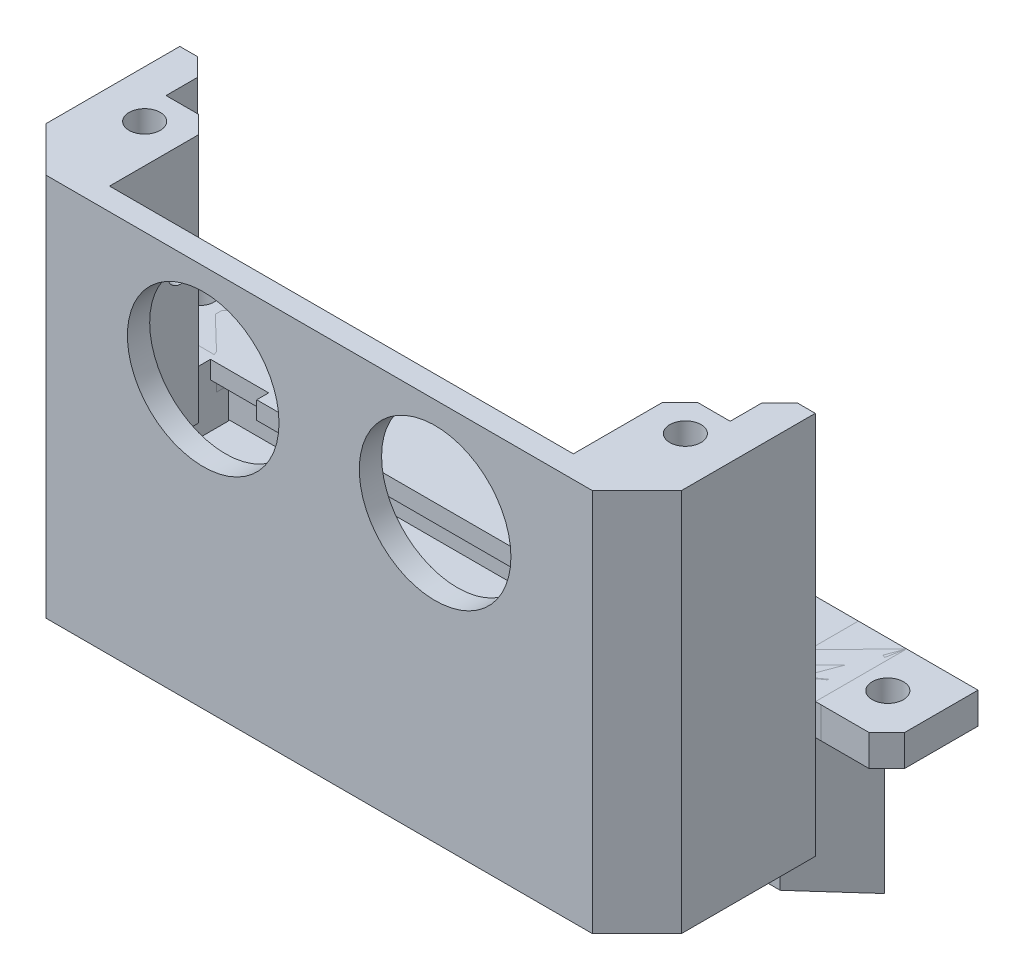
SolidWorks part; units mm, degrees
ref_plane "Front Plane" through (0, 0, 0) normal (0, 0, 1) x (1, 0, 0)
ref_plane "Top Plane" through (0, 0, 0) normal (0, 1, 0) x (1, 0, 0)
ref_plane "Right Plane" through (0, 0, 0) normal (1, 0, 0) x (0, 0, -1)
sketch "Sketch1" plane through (0, 0, 0) normal (1, 0, 0) x (0, 0, -1)
  line L0 (9.3411, 20.25) -> (11.3411, 20.25)
  line L1 (11.3411, -22.75) -> (11.3411, 22.75) construction
  line L2 (11.3411, -7.75) -> (11.3411, 20.25)
  line L3 (-7.5, -9.75) -> (-7.5, -14.75)
  line L4 (-10, -20.7698) -> (-10, 20.25)
  line L5 (9.3411, -9.75) -> (9.3411, 20.25)
  line L6 (-10, 20.25) -> (-7.5, 20.25)
  line L7 (-10, -22.75) -> (-10, 22.75) construction
  line L8 (-7.5, -14.75) -> (11.5, -14.75)
  line L9 (-2.5, -9.75) -> (11.5, -9.75) construction
  line L10 (9.3411, -20.75) -> (9.3411, 20.75) construction
  line L11 (11.5, -9.75) -> (11.5, -14.75) construction
  line L12 (9.3411, 20.75) -> (-8, 20.75) construction
  line L13 (-8, -20.75) -> (-8, 20.75) construction
  line L14 (9.3411, -20.75) -> (-8, -20.75) construction
  line L15 (-7.5, 20.25) -> (-7.5, -1.75)
  line L16 (11.5, -9.75) -> (9.3411, -9.75)
  line L17 (-7.5, -1.75) -> (-2.5, -1.75)
  line L18 (-2.5, -1.75) -> (-2.5, -9.75)
  line L19 (-2.5, -9.75) -> (-7.5, -9.75)
  line L20 (-7.5, -1.75) -> (-7.5, 20.25)
  line L21 (11.5, -14.75) -> (11.5, -9.75)
  line L22 (20.2433, -7.75) -> (20.2433, -22.4772)
  line L23 (15.7922, -7.75) -> (15.7922, -19.75) construction
  line L24 (11.3411, 22.75) -> (-10, 22.75) construction
  line L25 (-10, -20.7698) -> (8.5468, -20.7698)
  line L28 (11.3411, -22.75) -> (-10, -22.75) construction
  line L29 (20.2433, -32.7501) -> (11.5, -28.1484)
  line L30 (20.2433, -30.7482) -> (20.2433, -22.4772)
  line L31 (8.5468, -20.7698) -> (8.5468, -26.5822)
  line L32 (11.5, -28.1484) -> (8.5468, -26.5822)
  line L33 (20.2433, -32.7501) -> (20.2433, -30.7482)
  line L34 (20.2433, -7.75) -> (11.3411, -7.75)
  point P0 (0, 0)
  dimension "D1" = 19
  dimension "D2" = 12
  dimension "D5" = 22
  dimension "D6" = 8
  dimension "D7" = 5
  dimension "D3" = 5
  dimension "D4" = 2
extrude "Boss-Extrude1" add sketch "Sketch1" along normal blind 71.25
sketch "Sketch3" plane through (0, 20.25, 0) normal (0, 1, 0) x (1, 0, 0)
  line L0 (35.625, -10) -> (0, -10) construction
  line L2 (35.625, -10) -> (71.25, -10) construction
  line L3 (35.625, -10) -> (10.625, -10) construction
  line L4 (35.625, -10) -> (35.625, 35.4593) construction
  line L6 (10.625, -10) -> (10.625, 11.3411)
  line L8 (10.625, 11.3411) -> (0, 11.3411)
  line L9 (0, 11.3411) -> (0, -10)
  line L10 (10.625, -10) -> (0, -10)
  line L11 (60.625, -10) -> (71.25, -10)
  line L12 (71.25, 11.3411) -> (71.25, -10)
  line L13 (60.625, 11.3411) -> (71.25, 11.3411)
  line L14 (60.625, -10) -> (60.625, 11.3411)
  dimension "D1" = 71.25
  dimension "D2" = 35.625
  dimension "D3" = 25
  dimension "D4" = 50
  dimension "D5" = 10.625
extrude "Boss-Extrude2" add sketch "Sketch3" against normal blind 28
sketch "Sketch4" plane through (0, 20.25, 0) normal (0, 1, 0) x (1, 0, 0)
  line L0 (0, -10) -> (4.1022, -10)
  line L2 (35.625, 11.3411) -> (35.625, -10) construction
  line L4 (4.1022, -10) -> (4.1022, 11.3411)
  line L5 (71.25, 11.3411) -> (0, 11.3411) construction
  line L6 (4.1022, 11.3411) -> (0, 11.3411)
  line L7 (0, 11.3411) -> (0, -10)
  line L8 (71.25, 11.3411) -> (71.25, -10)
  line L9 (67.1478, 11.3411) -> (71.25, 11.3411)
  line L10 (67.1478, -10) -> (67.1478, 11.3411)
  line L11 (71.25, -10) -> (67.1478, -10)
  dimension "D1" = 63.0456
extrude "Boss-Extrude3" add sketch "Sketch4" against normal blind 41
sketch "Sketch7" plane through (0, 20.25, 0) normal (0, 1, 0) x (1, 0, 0)
  line L0 (35.625, -10) -> (35.625, 9.3411) construction
  line L2 (60.625, 9.3411) -> (10.625, 9.3411) construction
  line L3 (0, -10) -> (10.625, 11.5) construction
  line L4 (10.625, -7.5) -> (10.625, -10) construction
  line L5 (10.625, -10) -> (0, 11.3411) construction
  circle A0 centre (5.3125, 0.75) radius 1.75
  circle A1 centre (65.9375, 0.75) radius 1.75
  dimension "D1" = 3.5
extrude "Cut-Extrude1" cut sketch "Sketch7" against normal blind 9
sketch "Sketch9" plane through (0, -1.75, 0) normal (0, 1, 0) x (1, 0, 0)
  line L0 (10.625, -7.5) -> (32.125, -7.5) construction
  line L1 (60.625, -7.5) -> (39.125, -7.5) construction
  line L2 (31.425, -6.1941) -> (31.425, -2.5)
  line L3 (39.125, -7.5) -> (60.625, -7.5) construction
  line L4 (60.625, -2.5) -> (10.625, -2.5) construction
  line L5 (32.825, -6.1941) -> (32.825, -2.5)
  line L6 (10.625, -2.5) -> (60.625, -2.5) construction
  line L7 (33.825, -6.1941) -> (33.825, -2.5)
  line L8 (33.825, -2.5) -> (33.825, -6.1941)
  line L9 (35.225, -6.1941) -> (35.225, -2.5)
  line L10 (36.225, -6.1941) -> (36.225, -2.5)
  line L11 (36.225, -2.5) -> (37.625, -2.5)
  line L12 (37.625, -2.5) -> (37.625, -6.1941)
  line L13 (38.625, -6.1941) -> (38.625, -2.5)
  line L14 (38.625, -2.5) -> (40.025, -2.5)
  line L15 (40.025, -2.5) -> (40.025, -6.1941)
  line L16 (32.825, -2.5) -> (31.425, -2.5)
  line L17 (35.225, -2.5) -> (33.825, -2.5)
  line L18 (60.625, -2.5) -> (35.225, -2.5) construction
  line L19 (60.625, -2.5) -> (10.625, -2.5) construction
  line L20 (60.625, -7.5) -> (10.625, -7.5) construction
  line L21 (10.625, -7.5) -> (35.625, -7.5) construction
  line L22 (35.625, -7.5) -> (35.625, -2.5) construction
  arc A0 (31.425, -6.1941) -> (32.825, -6.1941) centre (32.125, -6.1941) ccw
  arc A1 (33.825, -6.1941) -> (35.225, -6.1941) centre (34.525, -6.1941) ccw
  arc A2 (36.225, -6.1941) -> (37.625, -6.1941) centre (36.925, -6.1941) ccw
  arc A3 (38.625, -6.1941) -> (40.025, -6.1941) centre (39.325, -6.1941) ccw
  point P7 (31.425, -4.347)
  point P8 (40.025, -4.347)
  dimension "D2" = 1.4
  dimension "D3" = 4
  dimension "D1" = 1
  dimension "D4" = 8.6
extrude "Cut-Extrude3" cut sketch "Sketch9" against normal blind 10 contours L2 A0 L5 M2 | L7 A1 L9 M2 | L10 L11 L12 A2 | L13 L14 L15 A3
sketch "Sketch10" plane through (0, -14.75, 0) normal (0, 1, 0) x (1, 0, 0)
  line L0 (4.1022, 11.3411) -> (67.25, 11.5) construction
  line L1 (67.25, 11.5) -> (35.6761, 11.4205) construction
  line L2 (35.6761, 11.4205) -> (35.625, -7.5) construction
  line L3 (67.1478, -7.5) -> (4.1022, -7.5) construction
  line L4 (35.6761, 11.4205) -> (67.25, 11.5) construction
  line L5 (35.6505, 1.9603) -> (57.6505, 1.9603) construction
  circle A0 centre (35.6505, 1.9603) radius 8.25
  circle A1 centre (57.6505, 1.9603) radius 8.25
  circle A2 centre (13.6509, 2.0791) radius 8.25
  dimension "D1" = 16.5
  dimension "D3" = 16.5
  dimension "D2" = 22
sketch "Sketch17" plane through (0, 20.25, 0) normal (0, 1, 0) x (1, 0, 0)
  line L0 (10.625, 9.3411) -> (10.625, 8.0011) construction
  line L1 (10.625, -7.5) -> (10.625, 9.3411) construction
  line L2 (10.625, 8.0011) -> (60.625, 8.0011)
  line L3 (60.625, 9.3411) -> (60.625, -7.5) construction
  line L4 (60.625, 8.0011) -> (60.625, 9.3411)
  line L5 (60.625, 9.3411) -> (10.625, 9.3411)
  line L10 (60.625, 9.3411) -> (10.625, 9.3411)
  line L11 (60.625, -7.5) -> (60.625, 9.3411)
  line L12 (10.625, -7.5) -> (60.625, -7.5)
  line L13 (10.625, 9.3411) -> (10.625, -7.5)
  line L17 (10.625, 9.3411) -> (10.625, 8.0011)
  dimension "D1" = 1.34
  dimension "D2" = 0
extrude "Boss-Extrude5" add sketch "Sketch17" against normal blind 30
sketch "Sketch12" plane through (0, 0, -11.3411) normal (0, 0, -1) x (-1, 0, 0)
  line L0 (-71.25, 20.25) -> (-35.625, 20.25) construction
  line L2 (-71.25, -10.39) -> (0, -10.39) construction
  line L8 (-26.625, 6.59) -> (-44.625, 6.59)
  line L9 (-26.625, 6.59) -> (-26.625, 14.59)
  line L10 (-26.625, 14.59) -> (-44.625, 14.59)
  line L11 (-44.625, 6.59) -> (-44.625, 14.59)
  point P13 (-33.125, 12.59)
  dimension "D1" = 8
  dimension "D2" = 18
extrude "Cut-Extrude6" cut sketch "Sketch12" against normal blind 8
sketch "Sketch18" plane through (71.25, 0, 0) normal (1, 0, 0) x (0, 0, -1)
  line L0 (11.3411, 20.25) -> (10.0011, 20.25)
  line L1 (-10, 20.25) -> (11.3411, 20.25) construction
  line L3 (11.3411, -7.75) -> (10.0011, -7.75)
  line L4 (10.0011, -7.75) -> (10.0011, 20.25)
  line L5 (11.3411, 20.25) -> (11.3411, -7.75)
  dimension "D1" = 1.34
extrude "Cut-Extrude9" cut sketch "Sketch18" against normal blind 80
sketch "Sketch20" plane through (0, 0, 10) normal (0, 0, 1) x (1, 0, 0)
  circle A0 centre (22.625, 9.25) radius 8.5
  circle A1 centre (48.625, 9.25) radius 8.5
extrude "Cut-Extrude12" cut sketch "Sketch20" against normal blind 5
chamfer "Chamfer1" distance 5 angle 45 2 edges at (0, -0.2599, 10) (71.25, -0.2599, 10)
sketch "Sketch22" plane through (0, 0, -20.2433) normal (0, 0, -1) x (-1, 0, 0)
  line L0 (-71.25, -7.75) -> (-68.2273, -7.75)
  line L1 (-71.25, -7.75) -> (0, -7.75) construction
  line L2 (-68.2273, -7.75) -> (-68.2273, -15.1136)
  line L5 (-71.25, -15.1136) -> (-71.25, -7.75)
  line L6 (-35.625, 20.25) -> (-35.625, -22.4772) construction
  line L7 (0, 20.25) -> (-71.25, 20.25) construction
  line L8 (0, -15.1136) -> (0, -7.75)
  line L10 (-3.0227, -7.75) -> (-3.0227, -15.1136)
  line L11 (0, -7.75) -> (-3.0227, -7.75)
  line L12 (-71.25, -15.1136) -> (-68.2273, -15.1136)
  line L13 (0, -15.1136) -> (-3.0227, -15.1136)
extrude "Boss-Extrude7" add sketch "Sketch22" against normal blind 10
sketch "Sketch23" plane through (71.25, 0, 0) normal (1, 0, 0) x (0, 0, -1)
  line L0 (15.7922, -22.4772) -> (15.7922, -7.75) construction
  line L1 (20.2433, -7.75) -> (10.0011, -7.75) construction
  line L2 (20.2433, -20.2501) -> (20.2433, -32.7501) construction
  line L3 (20.2433, -7.75) -> (20.2433, -32.7501) construction
sketch "Sketch25" plane through (71.25, 0, 0) normal (1, 0, 0) x (0, 0, -1)
  line L0 (8.5468, -20.7698) -> (20.2433, -20.7698) construction
  line L1 (20.2433, -7.75) -> (20.2433, -22.4772) construction
sketch "Sketch26" plane through (0, -17.3029, 9.1067) normal (0, -0.8849, 0.4657) x (1, 0, 0)
  line L0 (0, -33.1669) -> (0, -23.2865) construction
  line L1 (0, -23.2865) -> (0, -28.2267) construction
  circle A0 centre (35.625, -25.7267) radius 3
  circle A1 centre (14.0043, -25.7267) radius 3
  circle A2 centre (57.2457, -25.7267) radius 3
extrude "Cut-Extrude13" cut sketch "Sketch26" against normal blind 30
sketch "Sketch27" plane through (0, -17.3029, 9.1067) normal (0, -0.8849, 0.4657) x (1, 0, 0)
  circle A0 centre (14.0043, -25.7267) radius 3
  circle A1 centre (35.625, -25.7267) radius 3
  circle A2 centre (57.2457, -25.7267) radius 3
  circle A3 centre (14.0043, -25.7267) radius 2.5
  circle A4 centre (35.625, -25.7267) radius 2.5
  circle A5 centre (57.2457, -25.7267) radius 2.5
  dimension "D1" = 5
  dimension "D2" = 5
  dimension "D3" = 5
extrude "Boss-Extrude9" add sketch "Sketch27" against normal blind 3.5 separate body
sketch "Sketch29" plane through (0, -7.75, 0) normal (0, 1, 0) x (1, 0, 0)
  line L0 (0, 20.2433) -> (-8, 20.2433)
  line L1 (0, 20.2433) -> (0, 11.3411) construction
  line L2 (0, 20.2433) -> (0, 11.5) construction
  line L3 (0, 20.2433) -> (4.1326, 20.2433)
  line L4 (0, 11.5) -> (0, 8.5468) construction
  line L5 (0, 10.0234) -> (-8, 10.0234)
  line L6 (-8, 10.0234) -> (-8, 20.2433)
  line L7 (35.625, 20.2433) -> (35.625, -10) construction
  line L8 (71.25, 20.2433) -> (0, 20.2433) construction
  line L9 (66.25, -10) -> (5, -10) construction
  line L10 (79.25, 10.0234) -> (79.25, 20.2433)
  line L11 (71.25, 10.0234) -> (79.25, 10.0234)
  line L12 (71.25, 20.2433) -> (65.838, 20.2433)
  line L13 (71.25, 20.2433) -> (79.25, 20.2433)
  line L14 (4.1326, 20.2433) -> (4.1326, 10.0011)
  line L15 (0, 10.0011) -> (71.25, 10.0011) construction
  line L16 (4.1326, 10.0011) -> (0, 10.0234)
  line L17 (65.838, 20.2433) -> (65.838, 10.0011)
  line L18 (0, 10.0011) -> (71.25, 10.0011) construction
  line L19 (65.838, 10.0011) -> (71.25, 10.0234)
  dimension "D1" = 8
  dimension "D2" = 10.2199
extrude "Boss-Extrude10" add sketch "Sketch29" against normal blind 3.5 separate body
sketch "Sketch30" plane through (0, -7.75, 0) normal (0, 1, 0) x (1, 0, 0)
  line L0 (35.625, 20.2433) -> (35.625, -10) construction
  line L2 (71.25, 20.2433) -> (0, 20.2433) construction
  line L3 (66.25, -10) -> (5, -10) construction
  circle A0 centre (-3, 15.1334) radius 1.75
  circle A1 centre (74.25, 15.1334) radius 1.75
  dimension "D1" = 3.5
extrude "Cut-Extrude14" cut sketch "Sketch30" against normal through all
chamfer "Chamfer2" distance 2 angle 45 1 edges at (79.25, -9.5, -10.0234)
chamfer "Chamfer3" distance 2 angle 45 1 edges at (-8, -9.5, -10.0234)
sketch "Sketch31" plane through (0, 0, -20.2433) normal (0, 0, -1) x (-1, 0, 0)
  line L0 (-35.625, -10.3339) -> (-34.625, -10.3339)
  line L2 (-35.625, -23.2166) -> (-25.625, -23.2166)
  line L3 (-25.625, -23.2166) -> (-25.625, -19.3339)
  line L5 (-38.625, -16.7752) -> (-38.625, -23.2166)
  line L6 (-38.625, -23.2166) -> (-35.625, -23.2166)
  line L7 (-38.625, -16.7752) -> (-38.625, -10.3339)
  line L8 (-38.625, -10.3339) -> (-35.625, -10.3339)
  arc A0 (-34.625, -10.3339) -> (-25.625, -19.3339) centre (-34.625, -19.3339) cw
  ellipse E0 centre (-35.625, -16.7752) end of major axis (-35.625, -23.2166) minor radius 3 construction
  point P12 (-25.625, -10.3339)
  dimension "D2" = 9
  dimension "D1" = 10
extrude "Cut-Extrude15" cut sketch "Sketch31" against normal blind 5
sketch "Sketch32" plane through (0, 0, 10) normal (0, 0, 1) x (1, 0, 0)
  line L0 (35.625, 20.25) -> (35.625, -32.7501) construction
  line L1 (66.25, 20.25) -> (5, 20.25) construction
  line L2 (71.25, -32.7501) -> (0, -32.7501) construction
  line L3 (71.25, 20.25) -> (71.25, -20.7698) construction
  line L4 (-6, -7.75) -> (0, -7.75) construction
  line L5 (-6, -11.25) -> (0, -11.25) construction
  line L6 (-8, -11.25) -> (-8, -7.75) construction
  line L7 (0, -20.7698) -> (0, 20.25) construction
  line L8 (-6, -7.75) -> (-6, -11.25) construction
  line L9 (5, 20.25) -> (5, -20.7698) construction
  line L10 (71.25, -20.7698) -> (0, -20.7698) construction
  line L11 (66.25, -20.7698) -> (5, -20.7698) construction
  line L12 (71.25, -26.5822) -> (0, -26.5822) construction
  line L13 (71.25, -28.1484) -> (58.9909, -28.1484) construction
  circle A0 centre (22.625, 9.25) radius 8.5
  point P13 (71.25, -0.2599)
  point P19 (-3, -11.25)
  point P22 (-8, -9.5)
  point P27 (-6, -9.5)
  point P38 (65.1204, -28.1484)
  dimension "D1" = 17
  dimension "D2" = 71.25
  dimension "D3" = 53.0001
  dimension "D4" = 3.5
  dimension "D5" = 8
  dimension "D6" = 2
  dimension "D7" = 5
  dimension "D8" = 30.625
  dimension "D9" = 41.0198
  dimension "D10" = 5.8123
  dimension "D11" = 1.5662
  dimension "D12" = 4.6017
  dimension "D13" = 22.625
  dimension "D14" = 42.0001
  dimension "D15" = 30.0198
sketch "Sketch33" plane through (0, 0, -10.0011) normal (0, 0, -1) x (-1, 0, 0)
  line L0 (0, 20.25) -> (-71.25, 20.25) construction
  line L1 (-71.25, -32.7501) -> (0, -32.7501) construction
  line L2 (-71.25, 20.25) -> (-71.25, -7.75) construction
  line L3 (0, 20.25) -> (0, -7.75) construction
  line L4 (0, -7.75) -> (-71.25, -7.75) construction
  line L6 (-26.625, 14.59) -> (-44.625, 14.59) construction
  line L7 (-44.625, 6.59) -> (-26.625, 6.59) construction
  line L8 (-35.625, 20.25) -> (-35.625, -32.7501) construction
  line L9 (-26.625, 6.59) -> (-26.625, 14.59) construction
  line L10 (-44.625, 14.59) -> (-44.625, 6.59) construction
  line L11 (-79.25, -11.25) -> (-79.25, -7.75) construction
  line L12 (-65.838, -11.25) -> (-65.838, -7.75) construction
  line L13 (-79.25, -7.75) -> (-65.838, -7.75) construction
  line L14 (-79.25, -11.25) -> (-65.838, -11.25) construction
  line L15 (-57.2457, -10.3339) -> (-57.2457, -23.2166) construction
  line L16 (-60.2457, -16.7752) -> (-54.2457, -16.7752) construction
  line L17 (-71.25, -7.75) -> (-71.25, -32.7501) construction
  ellipse E1 centre (-57.2457, -16.7752) end of major axis (-57.2457, -23.2166) minor radius 3 construction
  point P2 (-35.625, 20.25)
  point P5 (-35.625, -32.7501)
  point P12 (-35.625, -7.75)
  point P18 (-35.625, 6.59)
  point P22 (-26.625, 10.59)
  point P25 (-44.625, 10.59)
  point P31 (-72.544, -11.25)
  point P35 (-79.25, -9.5)
  point P38 (-65.838, -9.5)
  point P49 (-57.2457, -16.7752)
  point P52 (-71.25, -20.2501)
  dimension "D1" = 53.0001
  dimension "D2" = 71.25
  dimension "D3" = 28
  dimension "D4" = 25.0001
  dimension "D5" = 8
  dimension "D6" = 18
  dimension "D7" = 9
  dimension "D8" = 35.625
  dimension "D9" = 5.66
  dimension "D10" = 13.412
  dimension "D11" = 3.5
  dimension "D12" = 12.8826
  dimension "D13" = 6
  dimension "D14" = 14.0043
  dimension "D15" = 18.6207
sketch "Sketch34" plane through (0, -7.75, 0) normal (0, 1, 0) x (1, 0, 0)
  line L0 (66.25, -10) -> (5, -10) construction
  line L1 (35.625, -10) -> (35.625, 20.2433) construction
  line L2 (35.625, -10) -> (5, -10) construction
  line L3 (5, -10) -> (0, -5) construction
  line L4 (0, -5) -> (0, 10.0011) construction
  line L5 (0, -5) -> (0, 10.0011) construction
  line L6 (0, 10.0011) -> (71.25, 10.0011) construction
  line L7 (0, 10.0011) -> (-6, 10.0234) construction
  line L8 (-6, 10.0234) -> (-8, 12.0234) construction
  line L9 (-8, 12.0234) -> (-8, 20.2433) construction
  line L10 (-8, 20.2433) -> (35.625, 20.2433) construction
  line L11 (35.625, -7.4356) -> (10.625, -7.5) construction
  line L12 (10.625, -7.5) -> (10.625, 8.0011) construction
  line L13 (10.625, 8.0011) -> (35.625, 8.0011) construction
  line L14 (10.625, 8.0011) -> (60.625, 8.0011) construction
  line L15 (4.1326, 10.0011) -> (4.1326, 20.2433) construction
  line L16 (31.425, -2.5) -> (10.625, -2.5) construction
  line L17 (31.425, -6.1941) -> (31.425, -2.5) construction
  line L18 (32.825, -6.1941) -> (32.825, -2.5) construction
  line L19 (40.025, -2.5) -> (40.025, -6.1941) construction
  circle A0 centre (5.3125, 0.75) radius 1.75
  circle A1 centre (-3, 15.1334) radius 1.75
  point P38 (4.1326, 15.1222)
  point P39 (-3, 10.0122)
  point P40 (23.125, -7.4678)
  point P41 (0, 2.5005)
  point P46 (31.425, -4.347)
  point P47 (23.125, 8.0011)
  point P50 (32.825, -4.347)
  point P54 (40.025, -4.347)
  dimension "D1" = 30.625
  dimension "D11" = 3.5
  dimension "D17" = 3.5
  dimension "D2" = 7.0711
  dimension "D3" = 15.0011
  dimension "D4" = 6
  dimension "D5" = 2.8284
  dimension "D6" = 8.2199
  dimension "D7" = 43.625
  dimension "D8" = 35.625
  dimension "D9" = 31.4924
  dimension "D10" = 7.1326
  dimension "D12" = 5.1211
  dimension "D13" = 2.5322
  dimension "D14" = 15.5011
  dimension "D15" = 5.3125
  dimension "D16" = 9.2511
  dimension "D18" = 4.9678
  dimension "D19" = 20.8
  dimension "D20" = 15.4688
  dimension "D21" = 30.2433
  dimension "D22" = 1.4
  dimension "D23" = 8.6
sketch "Sketch35" plane through (0, -20.7698, 0) normal (0, -1, 0) x (1, 0, 0)
  line L0 (35.625, 10) -> (35.625, -20.2433) construction
  line L1 (66.25, 10) -> (5, 10) construction
  line L2 (35.625, 10) -> (66.25, 10) construction
  line L3 (71.25, -11.5) -> (58.9909, -11.5) construction
  line L4 (71.25, -20.2433) -> (0, -20.2433) construction
  line L5 (71.25, -8.5468) -> (0, -8.5468) construction
  circle A0 centre (57.6505, -1.9603) radius 5
  point P18 (65.1204, -11.5)
  dimension "D1" = 10
  dimension "D2" = 8.7433
  dimension "D3" = 2.9532
  dimension "D4" = 18.5468
sketch "Sketch36" plane through (71.25, 0, 0) normal (1, 0, 0) x (0, 0, -1)
  line L0 (-5, 20.25) -> (10.0011, 20.25) construction
  line L1 (-5, -20.7698) -> (8.5468, -20.7698) construction
  line L2 (-10, -20.7698) -> (-10, 20.25) construction
  line L3 (-5, 20.25) -> (-5, -20.7698) construction
  line L4 (10.0011, 20.25) -> (10.0011, -7.75) construction
  line L5 (8.5468, -20.7698) -> (8.5468, -26.5822) construction
  line L6 (20.2433, -7.75) -> (20.2433, -32.7501) construction
  line L7 (10.0011, 20.25) -> (10.0234, -7.75) construction
  line L8 (10.0234, -7.75) -> (20.2433, -7.75) construction
  line L9 (20.2433, -7.75) -> (20.2433, -32.7501) construction
  line L10 (20.2433, -32.7501) -> (8.5468, -26.5822) construction
  line L11 (8.5468, -26.5822) -> (8.5468, -20.7698) construction
  line L12 (12.0234, -11.25) -> (20.2433, -11.25) construction
  line L13 (20.2433, -32.7501) -> (8.5468, -32.7501) construction
  line L14 (8.5468, -32.7501) -> (8.5468, -26.5822) construction
  point P2 (2.5005, 20.25)
  point P5 (1.7734, -20.7698)
  point P20 (15.1334, -7.75)
  point P31 (16.1334, -11.25)
  dimension "D1" = 41.0198
  dimension "D2" = 5
  dimension "D3" = 15.0011
  dimension "D4" = 18.5468
  dimension "D5" = 10.2423
  dimension "D6" = 28
  dimension "D7" = 3.5
  dimension "D8" = 25.0001
  dimension "D9" = 5.8123
  dimension "D10" = 13.2231
  dimension "D11" = 27.804
sketch "Sketch37" plane through (0, 0, -8.0011) normal (0, 0, 1) x (1, 0, 0)
  line L1 (35.625, 20.25) -> (35.625, -32.7501) construction
  line L4 (0, 20.25) -> (3.7301, 20.25) construction
  line L9 (3.7301, 20.25) -> (3.7301, 11.25) construction
  line L12 (3.7301, 11.25) -> (6.8922, 11.25) construction
  line L13 (6.8922, 11.25) -> (6.8922, 20.25) construction
  line L14 (6.8922, 20.25) -> (35.625, 20.25) construction
  line L15 (0, 20.25) -> (0, -20.7698) construction
  line L16 (0, -20.7698) -> (35.625, -20.7698) construction
  line L18 (10.625, -9.75) -> (4.1022, -9.75) construction
  line L19 (4.1022, -9.75) -> (4.1022, -14.75) construction
  line L22 (4.1022, -14.75) -> (5.6241, -14.75) construction
  line L23 (5.6241, -14.75) -> (5.6241, -18.75) construction
  line L25 (5.6241, -18.75) -> (9.0579, -18.75) construction
  line L27 (9.0579, -18.75) -> (9.0579, -20.7698) construction
  line L28 (21.6353, -14.75) -> (21.6353, -18.75) construction
  line L29 (21.6353, -18.75) -> (18.1891, -18.75) construction
  line L30 (18.1891, -18.75) -> (18.1891, -20.7698) construction
  line L31 (21.6353, -14.75) -> (27.6399, -14.75) construction
  line L32 (27.6399, -14.75) -> (27.6399, -18.75) construction
  line L33 (27.6399, -18.75) -> (31.0593, -18.75) construction
  line L35 (31.0593, -18.75) -> (31.0593, -20.7698) construction
  line L36 (31.0593, -20.7698) -> (35.625, -20.7698) construction
sketch "Sketch38" plane through (10.625, 0, 0) normal (1, 0, 0) x (0, 0, -1)
  line L0 (-10, 20.25) -> (-7.5, 20.25) construction
  line L2 (-7.5, 20.25) -> (-7.5, -1.75) construction
  line L3 (-7.5, -1.75) -> (-2.5, -1.75) construction
  line L4 (-2.5, -1.75) -> (-2.5, -9.75) construction
  line L5 (-2.5, -9.75) -> (-7.5, -9.75) construction
  line L6 (-7.5, -9.75) -> (-7.5, -14.75) construction
  line L7 (-7.5, -14.75) -> (-6.2897, -14.75) construction
  line L10 (-6.2897, -14.75) -> (-6.2897, -18.75) construction
  line L12 (-6.2897, -18.75) -> (-3.0631, -18.75) construction
  line L13 (-3.0631, -18.75) -> (-3.0631, -20.7698) construction
  line L15 (-3.0631, -20.7698) -> (-10, -20.7698) construction
  line L16 (-3.0631, -20.7698) -> (6.9603, -20.7698) construction
  line L18 (6.9603, -20.7698) -> (6.9603, -18.75) construction
  line L20 (6.9603, -18.75) -> (10.2103, -18.75) construction
  line L22 (10.2103, -18.75) -> (10.2103, -14.75) construction
  line L23 (10.2103, -14.75) -> (11.5, -14.75) construction
  line L24 (11.5, -14.75) -> (11.5, -11.25) construction
  line L27 (11.5, -11.25) -> (10.0011, -11.25) construction
  line L28 (10.0011, -11.25) -> (10.0011, -9.75) construction
  line L31 (10.0011, -9.75) -> (8.0011, -9.75) construction
  line L33 (8.0011, -9.75) -> (8.0011, 6.59) construction
  line L34 (8.0011, 6.59) -> (8.0011, 14.59) construction
  line L37 (8.0011, 14.59) -> (8.0011, 20.25) construction
  line L38 (8.0011, 20.25) -> (10.0011, 20.25) construction
  line L39 (6.9603, -20.7698) -> (8.5468, -20.7698) construction
  line L40 (8.5468, -20.7698) -> (8.5468, -26.5822) construction
  line L41 (8.5468, -26.5822) -> (20.2433, -32.7501) construction
  line L42 (20.2433, -32.7501) -> (15.8717, -30.4493) construction
  line L44 (15.8717, -30.4493) -> (17.5018, -27.352) construction
  line L47 (17.5018, -27.352) -> (17.9442, -27.5849) construction
  line L49 (17.9442, -27.5849) -> (20.2433, -23.2166) construction
  line L50 (15.2433, -19.834) -> (12.6347, -24.7904) construction
  line L53 (12.6347, -24.7904) -> (13.0772, -25.0233) construction
  line L55 (13.0772, -25.0233) -> (11.4508, -28.1135) construction
  line L56 (10.0011, 20.25) -> (10.0011, 14.59) construction
  line L57 (10.0011, 14.59) -> (10.0011, 6.59) construction
  line L58 (10.0011, 6.59) -> (10.0011, -7.75) construction
  line L59 (10.0011, -7.75) -> (20.2433, -7.75) construction
  line L60 (20.2433, -7.75) -> (20.2433, -10.3339) construction
  line L61 (20.2433, -10.3339) -> (15.2433, -10.3339) construction
  line L63 (15.2433, -10.3339) -> (15.2433, -19.834) construction
sketch "Sketch39" plane through (0, -1.75, 0) normal (0, 1, 0) x (1, 0, 0)
  line L0 (10.625, -2.5) -> (10.625, -7.5)
  line L1 (10.625, -7.5) -> (60.625, -7.5)
  line L2 (60.625, -7.5) -> (60.625, -2.5)
  line L3 (60.625, -2.5) -> (10.625, -2.5)
sketch "Sketch40" plane through (10.625, 0, 0) normal (1, 0, 0) x (0, 0, -1)
  line L0 (-7.5, 20.25) -> (-7.5, -1.75) construction
  line L1 (-7.5, 20.25) -> (8.0011, 20.25) construction
  circle A0 centre (0.5, 8.25) radius 1.5
  dimension "D1" = 8
  dimension "D2" = 3
  dimension "D3" = 12
extrude "Cut-Extrude16" cut sketch "Sketch40" against normal blind 4
sketch "Sketch41" plane through (60.625, 0, 0) normal (-1, 0, 0) x (0, 0, 1)
  line L0 (7.5, -1.75) -> (7.5, 20.25) construction
  line L1 (-8.0011, 20.25) -> (7.5, 20.25) construction
  circle A0 centre (-0.5, 8.25) radius 1.5
  dimension "D1" = 3
  dimension "D2" = 8
  dimension "D3" = 12
extrude "Cut-Extrude17" cut sketch "Sketch41" against normal blind 4
extrude "Cut-Extrude18" cut sketch "Sketch39" against normal blind 8
sketch "Sketch42" plane through (0, 20.25, 0) normal (0, 1, 0) x (1, 0, 0)
  line L0 (4, 10.0011) -> (4, 4.4586)
  line L1 (0, 10.0011) -> (71.25, 10.0011) construction
  line L2 (4, 4.4586) -> (67.25, 4.4586)
  line L3 (67.25, 4.4586) -> (67.25, 10.0011)
  line L4 (0, 10.0011) -> (71.25, 10.0011) construction
  line L5 (71.25, -5) -> (71.25, 10.0011) construction
  line L6 (0, -5) -> (0, 10.0011) construction
  line L7 (67.25, 10.0011) -> (4, 10.0011)
  dimension "D1" = 4
  dimension "D2" = 4
extrude "Cut-Extrude19" cut sketch "Sketch42" against normal up to surface (28 mm away)
sketch "Sketch43" plane through (0, -11.25, 0) normal (0, -1, 0) x (1, 0, 0)
  line L0 (0, -10.0234) -> (2.5, -10.0234)
  line L1 (2.5, -10.0234) -> (2.5, -20.2433)
  line L2 (71.25, -20.2433) -> (0, -20.2433) construction
  line L3 (2.5, -20.2433) -> (0, -20.2433)
  line L4 (4.1326, -20.2433) -> (-8, -20.2433) construction
  line L5 (0, -20.2433) -> (0, -10.0234)
  line L6 (35.625, 10) -> (35.625, -20.2433) construction
  line L7 (66.25, 10) -> (5, 10) construction
  line L8 (71.25, -20.2433) -> (71.25, -10.0234)
  line L9 (68.75, -20.2433) -> (71.25, -20.2433)
  line L10 (71.25, -10.0234) -> (68.75, -10.0234)
  line L11 (68.75, -10.0234) -> (68.75, -20.2433)
  dimension "D1" = 2.5
extrude "Cut-Extrude20" cut sketch "Sketch43" along normal up to surface (21.5001 mm away)
chamfer "Chamfer5" distance 2 angle 45 2 edges at (68.75, -11.25, -15.1334) (2.5, -11.25, -15.1334)
sketch "Sketch44" plane through (0, -17.2091, 9.1268) normal (0, -0.8834, 0.4685) x (1, 0, 0)
  line L0 (2.5, -21.6767) -> (0, -21.6767)
  line L1 (0, -21.6767) -> (0, -20.0053)
  line L2 (0, -20.0053) -> (2.5, -20.0053)
  line L3 (71.25, -20.0053) -> (0, -20.0053) construction
  line L4 (2.5, -20.0053) -> (2.5, -21.6767)
  line L5 (35.625, -20.0053) -> (35.625, -33.6822) construction
  line L6 (68.75, -20.0053) -> (68.75, -21.6767)
  line L7 (71.25, -20.0053) -> (68.75, -20.0053)
  line L8 (71.25, -21.6767) -> (71.25, -20.0053)
  line L9 (68.75, -21.6767) -> (71.25, -21.6767)
sketch "Sketch45" plane through (0, -20.7698, 0) normal (0, -1, 0) x (1, 0, 0)
  line L0 (0, -8.5468) -> (2.5, -8.5468)
  line L1 (2.5, -8.5468) -> (2.5, -10.0234)
  line L2 (2.5, -10.0234) -> (0, -10.0234)
  line L3 (0, -10.0234) -> (0, -8.5468)
  line L4 (35.625, -8.5468) -> (35.625, -20.6296) construction
  line L5 (71.25, -10.0234) -> (71.25, -8.5468)
  line L6 (68.75, -10.0234) -> (71.25, -10.0234)
  line L7 (68.75, -8.5468) -> (68.75, -10.0234)
  line L8 (71.25, -8.5468) -> (68.75, -8.5468)
extrude "Cut-Extrude21" cut sketch "Sketch45" along normal blind 8
fillet "Fillet1" radius 300 1 edges at (0, -9.5, -10.0234)
fillet "Fillet2" radius 300 1 edges at (71.25, -9.5, -10.0234)
sketch "Sketch46" plane through (0, 20.25, 0) normal (0, 1, 0) x (1, 0, 0)
  line L0 (60.625, -7.5) -> (61.625, -7.5)
  line L1 (9.625, -7.5) -> (9.625, 1.6997)
  line L2 (9.625, 4.4586) -> (9.625, 1.6997)
  line L3 (67.1478, -7.5) -> (4.1022, -7.5) construction
  line L4 (4, 4.4586) -> (10.625, 4.4586) construction
  line L5 (61.625, -7.5) -> (61.625, 4.4586)
  line L6 (60.625, 4.4586) -> (67.25, 4.4586) construction
  line L7 (61.625, 4.4586) -> (9.625, 4.4586)
  line L8 (9.625, -7.5) -> (61.625, -7.5)
  dimension "D1" = 1
extrude "Cut-Extrude22" cut sketch "Sketch46" against normal blind 30 contours L7 M16 M18 M17 | L1 L8 L2 M18 M19
sketch "Sketch47" plane through (0, -20.7698, 0) normal (0, -1, 0) x (1, 0, 0)
  line L0 (0, 5) -> (0, -10.0234)
  line L1 (0, -10.0234) -> (71.25, -10.0234)
  line L2 (71.25, -10.0234) -> (71.25, 5)
  line L3 (71.25, 5) -> (66.25, 10)
  line L4 (66.25, 10) -> (5, 10)
  line L5 (5, 10) -> (0, 5)
extrude "Boss-Extrude12" add sketch "Sketch47" along normal blind 2
sketch "Sketch48" plane through (0, -22.7698, 0) normal (0, -1, 0) x (1, 0, 0)
  circle A0 centre (13.6509, -0.5791) radius 8.25
  circle A1 centre (13.6509, -0.5791) radius 5
  circle A2 centre (35.6505, -0.4603) radius 8.25
  circle A3 centre (35.6505, -0.4603) radius 5
  circle A4 centre (57.6505, -0.4603) radius 8.25
  circle A5 centre (57.6505, -0.4603) radius 5
extrude "Cut-Extrude23" cut sketch "Sketch48" against normal blind 4
sketch "Sketch49" plane through (0, -22.7698, 0) normal (0, -1, 0) x (1, 0, 0)
  circle A0 centre (13.6509, -0.5791) radius 5
  circle A1 centre (35.6505, -0.4603) radius 5
  circle A2 centre (57.6505, -0.4603) radius 5
extrude "Cut-Extrude24" cut sketch "Sketch49" against normal blind 10
sketch "Sketch50" plane through (0, -18.7698, 0) normal (0, -1, 0) x (1, 0, 0)
  line L1 (21.6509, -2.5946) -> (5.6509, -2.5946)
  line L2 (21.6509, -2.5946) -> (21.6509, 1.4365)
  line L3 (21.6509, 1.4365) -> (5.6509, 1.4365)
  line L4 (5.6509, -2.5946) -> (5.6509, 1.4365)
  line L5 (21.6509, -2.5946) -> (5.6509, 1.4365) construction
  line L6 (21.6509, 1.4365) -> (5.6509, -2.5946) construction
  line L7 (43.6505, -2.4758) -> (27.6505, -2.4758)
  line L8 (43.6505, -2.4758) -> (43.6505, 1.5553)
  line L9 (43.6505, 1.5553) -> (27.6505, 1.5553)
  line L10 (27.6505, -2.4758) -> (27.6505, 1.5553)
  line L11 (43.6505, -2.4758) -> (27.6505, 1.5553) construction
  line L12 (43.6505, 1.5553) -> (27.6505, -2.4758) construction
  line L13 (65.6505, -2.4758) -> (49.6505, -2.4758)
  line L14 (65.6505, -2.4758) -> (65.6505, 1.5553)
  line L15 (65.6505, 1.5553) -> (49.6505, 1.5553)
  line L16 (49.6505, -2.4758) -> (49.6505, 1.5553)
  line L17 (65.6505, -2.4758) -> (49.6505, 1.5553) construction
  line L18 (65.6505, 1.5553) -> (49.6505, -2.4758) construction
  circle A0 centre (13.6509, -0.5791) radius 8.25 construction
  circle A1 centre (35.6505, -0.4603) radius 8.25 construction
  circle A2 centre (57.6505, -0.4603) radius 8.25 construction
  point P0 (13.6509, -0.5791)
  point P8 (35.6505, -0.4603)
  point P16 (57.6505, -0.4603)
  dimension "D1" = 16
  dimension "D2" = 16
  dimension "D3" = 16
extrude "Cut-Extrude25" cut sketch "Sketch50" against normal up to surface (4.0198 mm away)
sketch "Sketch51" plane through (79.25, 0, 0) normal (1, 0, 0) x (0, 0, -1)
  line L0 (20.2433, -7.75) -> (30.2433, -7.75)
  dimension "D1" = 10
sketch "Sketch52" plane through (0, 20.25, 0) normal (0, 1, 0) x (1, 0, 0)
  line L0 (0, 10.0234) -> (0, 13.0234)
  line L1 (9.625, 10.0011) -> (9.625, 11.0011)
  line L2 (71.25, 10.0234) -> (71.25, 13.0234)
  line L3 (71.25, 13.0234) -> (0, 13.0234)
  line L4 (4, 8.4714) -> (4, 4.4586)
  line L5 (4, 4.4586) -> (9.625, 4.4586)
  line L6 (9.625, 4.4586) -> (9.625, 10.0011)
  line L7 (0, 10.0234) -> (0, 8.4714)
  line L8 (61.625, 11.0011) -> (9.625, 11.0011)
  line L9 (61.625, 4.4586) -> (61.625, 10.0207)
  line L10 (61.625, 4.4586) -> (67.25, 4.4586)
  line L11 (67.25, 4.4586) -> (67.25, 8.9451)
  line L12 (71.25, 10.0234) -> (71.25, 8.9451)
  line L13 (9.625, 11.0011) -> (9.625, 10.0011)
  line L14 (61.625, 11.0011) -> (61.625, 10.0207)
  line L15 (0, -5) -> (0, 10.0011) construction
  line L16 (0, 8.4714) -> (4, 8.4714)
  line L17 (61.625, 11.0011) -> (61.625, 10.0207)
  line L18 (67.25, 8.9451) -> (71.25, 8.9451)
  line L19 (71.25, -5) -> (71.25, 10.0011) construction
  line L20 (71.25, 8.9451) -> (71.25, 10.0234)
  line L21 (0, 10.0234) -> (0, 8.4714)
  dimension "D1" = 3
  dimension "D2" = 1
sketch "Sketch55" plane through (0, 20.25, 0) normal (0, 1, 0) x (1, 0, 0)
  line L0 (9.625, -7.5) -> (9.625, -8.1)
  line L2 (61.625, -7.5) -> (61.625, -8.1)
  line L3 (61.625, -8.1) -> (9.625, -8.1)
  line L4 (9.625, -7.5) -> (61.625, -7.5)
  line L5 (9.625, -7.5) -> (61.625, -7.5)
  dimension "D1" = 0.6
chamfer "Chamfer6" distance 2 angle 45 4 edges at (4, 6.25, -10.0011) (9.625, 6.25, -4.4586) (61.625, 6.25, -4.4586) (67.25, 6.25, -10.0011)
sketch "Sketch56" plane through (0, 20.25, 0) normal (0, 1, 0) x (1, 0, 0)
  line L0 (35.625, -7.5) -> (35.625, 10.0935) construction
  line L1 (61.625, -7.5) -> (9.625, -7.5) construction
  line L2 (35.625, 20.2433) -> (35.625, -10) construction
  line L3 (35.625, 10.0935) -> (9.625, -7.5) construction
  line L4 (9.625, -7.5) -> (9.625, 11.3213) construction
  line L5 (9.625, 11.3213) -> (35.625, 11.3213) construction
  line L6 (35.625, 11.3213) -> (35.625, 10.0935) construction
  line L7 (35.625, -7.5) -> (61.625, -7.5) construction
  line L8 (61.625, -7.5) -> (61.625, 10.7074) construction
  line L9 (61.625, 10.7074) -> (61.625, 11.3213) construction
  line L10 (61.625, 11.3213) -> (35.625, 11.3213) construction
  line L11 (65.9375, 0.75) -> (65.9375, -10)
  line L12 (66.25, -10) -> (5, -10) construction
  line L13 (65.9375, 0.75) -> (71.25, 0.75)
  line L14 (71.25, -5) -> (71.25, 10.0011) construction
  dimension "D1" = 18.8213
  dimension "D2" = 52
  dimension "D3" = 5.3125
  dimension "D4" = 10.75
